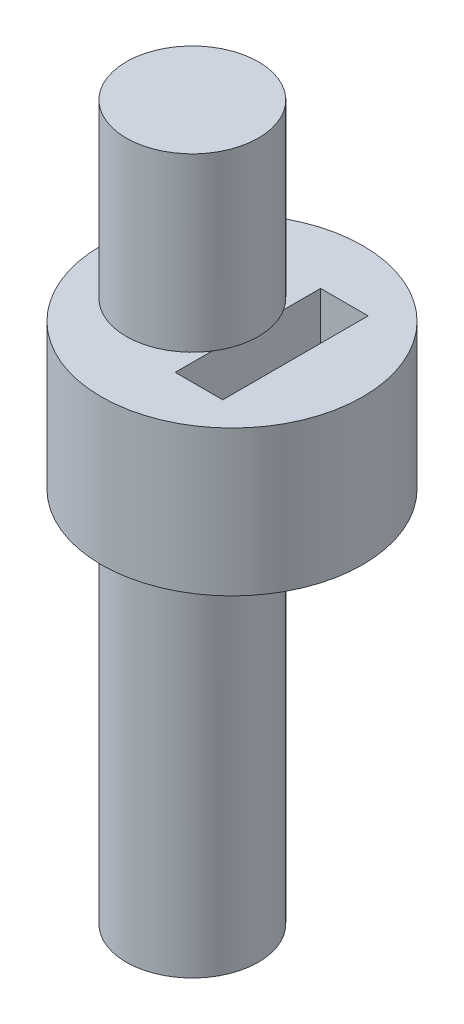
SolidWorks part; units mm, degrees
ref_plane "Front Plane" through (0, 0, 0) normal (0, 0, 1) x (1, 0, 0)
ref_plane "Top Plane" through (0, 0, 0) normal (0, 1, 0) x (1, 0, 0)
ref_plane "Right Plane" through (0, 0, 0) normal (1, 0, 0) x (0, 0, -1)
sketch "Sketch1" plane through (0, 0, 0) normal (0, 1, 0) x (1, 0, 0)
  circle A0 centre (0, 0) radius 2.5
  circle A1 centre (0, 0) radius 2.55 construction
  dimension "D1" = 5
  dimension "D2" = 5.1
extrude "Boss-Extrude1" add sketch "Sketch1" along normal blind 15
sketch "Sketch2" plane through (0, 15, 0) normal (0, 1, 0) x (1, 0, 0)
  circle A0 centre (1.5, 0) radius 4.95
  dimension "D1" = 9.9
  dimension "D2" = 1.5
extrude "Boss-Extrude2" add sketch "Sketch2" along normal blind 5.5
sketch "Sketch3" plane through (0, 20.5, 0) normal (0, 1, 0) x (1, 0, 0)
  circle A2 centre (0, 0) radius 2.5 construction
  circle A3 centre (0, 0) radius 2.5
extrude "Boss-Extrude3" add sketch "Sketch3" along normal blind 6.5
sketch "Sketch4" [suppressed] plane through (0, 27, 0) normal (0, 1, 0) x (1, 0, 0)
  line L0 (-2.0842, 3.4141) -> (-1.5, 0)
  line L1 (-1.5, 0) -> (-2.0842, -3.4141)
  circle A0 centre (0, 0) radius 2.5 construction
  circle A1 centre (0, 0) radius 2.5 construction
  arc A2 (-2.0842, 3.4141) -> (-2.0842, -3.4141) centre (0, 0) ccw
  circle A3 centre (1.5, 0) radius 4.95 construction
  dimension "D1" = 1.5
extrude "Cut-Extrude1" [suppressed] cut sketch "Sketch4" against normal up to surface (6.5 mm away)
fillet "Fillet1" [suppressed] radius 1
sketch "Sketch6" plane through (0, 0, 0) normal (0, -1, 0) x (1, 0, 0)
  line L1 (-3.6662, 0) -> (-1.8331, -3.175)
  line L2 (-1.8331, -3.175) -> (1.8331, -3.175)
  line L3 (1.8331, -3.175) -> (3.6662, 0)
  line L4 (3.6662, 0) -> (1.8331, 3.175)
  line L5 (1.8331, 3.175) -> (-1.8331, 3.175)
  line L6 (-1.8331, 3.175) -> (-3.6662, 0)
  circle A0 centre (0, 0) radius 3.175 construction
  dimension "D1" = 6.35
extrude "Cut-Extrude2" [suppressed] cut sketch "Sketch6" against normal blind 6 flip side to cut
fillet "Fillet2" [suppressed] radius 0.5
sketch "Sketch7" plane through (0, 15, 0) normal (0, -1, 0) x (1, 0, 0)
  line L0 (2, 1.5) -> (2, -1.5) construction
  line L1 (2.1, 2.75) -> (3.9, 2.75)
  line L2 (2.1, 2.75) -> (2.1, -2.75)
  line L3 (2.1, -2.75) -> (3.9, -2.75)
  line L4 (3.9, 2.75) -> (3.9, -2.75)
  line L5 (2.1, 2.75) -> (3.9, -2.75) construction
  line L6 (2.1, -2.75) -> (3.9, 2.75) construction
  circle A0 centre (1.5, 0) radius 4.95 construction
  circle A1 centre (0, 0) radius 2.5 construction
  circle A2 centre (1.5, 0) radius 4.95 construction
  circle A3 centre (0, 0) radius 2.5 construction
  point P6 (3, 0)
  dimension "D1" = 3.95
  dimension "D2" = 1.8
  dimension "D3" = 5.5
  dimension "D4" = 4.5
  dimension "D5" = 0.2
extrude "Cut-Extrude3" cut sketch "Sketch7" against normal up to surface (5.5 mm away)
